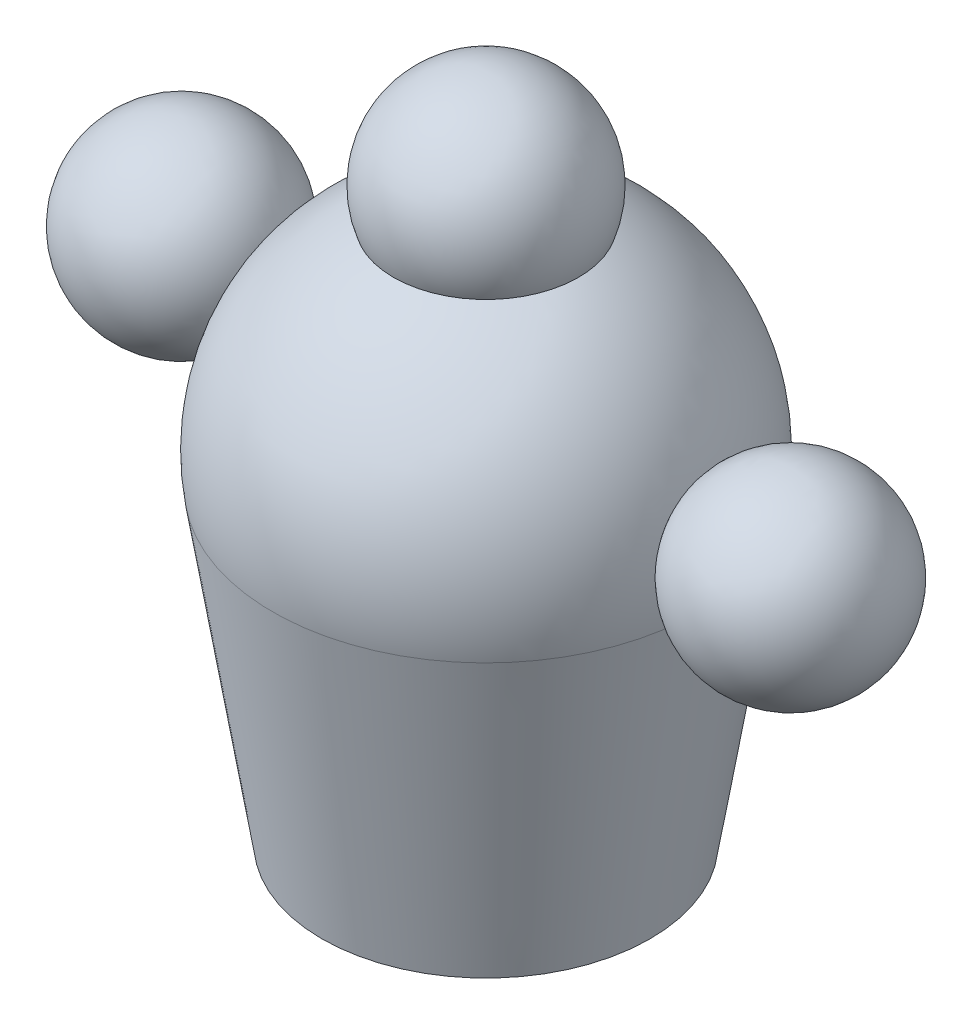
SolidWorks part; units mm, degrees
ref_plane "Přední" through (0, 0, 0) normal (0, 0, 1) x (1, 0, 0)
ref_plane "Horní" through (0, 0, 0) normal (0, 1, 0) x (1, 0, 0)
ref_plane "Pravá" through (0, 0, 0) normal (1, 0, 0) x (0, 0, -1)
sketch "Skica1" plane through (0, 0, 0) normal (0, 0, 1) x (1, 0, 0)
  line L0 (0, 0) -> (0, 293.25) construction
  line L1 (112.125, 161.7648) -> (86.25, 0)
  line L2 (86.25, 0) -> (0, 0)
  line L3 (0, 293.25) -> (-22.3209, 293.25) construction
  line L4 (0, 0) -> (0, 293.25)
  arc A0 (0, 293.25) -> (112.125, 161.7648) centre (0, 179.6997) cw
  dimension "D1" = 293.25
  dimension "D2" = 224.25
  dimension "D3" = 172.5
revolve "Otočit kolem osy1" add sketch "Skica1" angle 360 about L0
sketch "Skica7" plane through (0, 0, 0) normal (0, 0, 1) x (1, 0, 0)
  line L0 (-71.875, 0) -> (71.875, 0) construction
  line L1 (-86.25, 0) -> (86.25, 0) construction
  line L2 (0, 38.5735) -> (0, -47.6765) construction
  line L3 (0, 38.5735) -> (0, 0)
  line L4 (0, 0) -> (-71.875, 0)
  arc A0 (-71.875, 0) -> (0, 38.5735) centre (0, -47.6765) cw
  arc A1 (0, 38.5735) -> (71.875, 0) centre (0, -47.6765) cw construction
  dimension "D2" = 86.25
  dimension "D1" = 143.75
revolve "Odebrat otočením1" cut sketch "Skica7" angle 360 about L2
ref_plane "Rovina3" through (0, 0, -90) normal (0, 0, 1) x (1, 0, 0)
other "Odebrat povrchem3"
ref_plane "Rovina4" through (0, 201.25, 0) normal (0, 1, 0) x (-1, 0, 0)
sketch "Skica8" plane through (0, 201.25, 0) normal (0, 1, 0) x (-1, 0, 0)
  line L0 (109.6875, 0) -> (210.3125, 0)
  arc A0 (109.6875, 0) -> (210.3125, 0) centre (160, 0) cw
  dimension "D1" = 100.625
  dimension "D2" = 160
revolve "Otočit kolem osy3" add sketch "Skica8" angle 360 about L0
mirror "Zrcadlit2" about plane through (0, 0, 0) normal (1, 0, 0) of "Otočit kolem osy3"
sketch "Skica9" plane through (0, 0, 0) normal (0, 0, 1) x (1, 0, 0)
  line L0 (0, 248.25) -> (0, 351.75)
  line L1 (0, 351.75) -> (0, 383.9689) construction
  line L2 (-71.875, 0) -> (71.875, 0) construction
  arc A0 (0, 351.75) -> (0, 248.25) centre (0, 300) ccw
  dimension "D1" = 51.75
  dimension "D2" = 300
revolve "Otočit kolem osy4" add sketch "Skica9" angle 360 about L1
